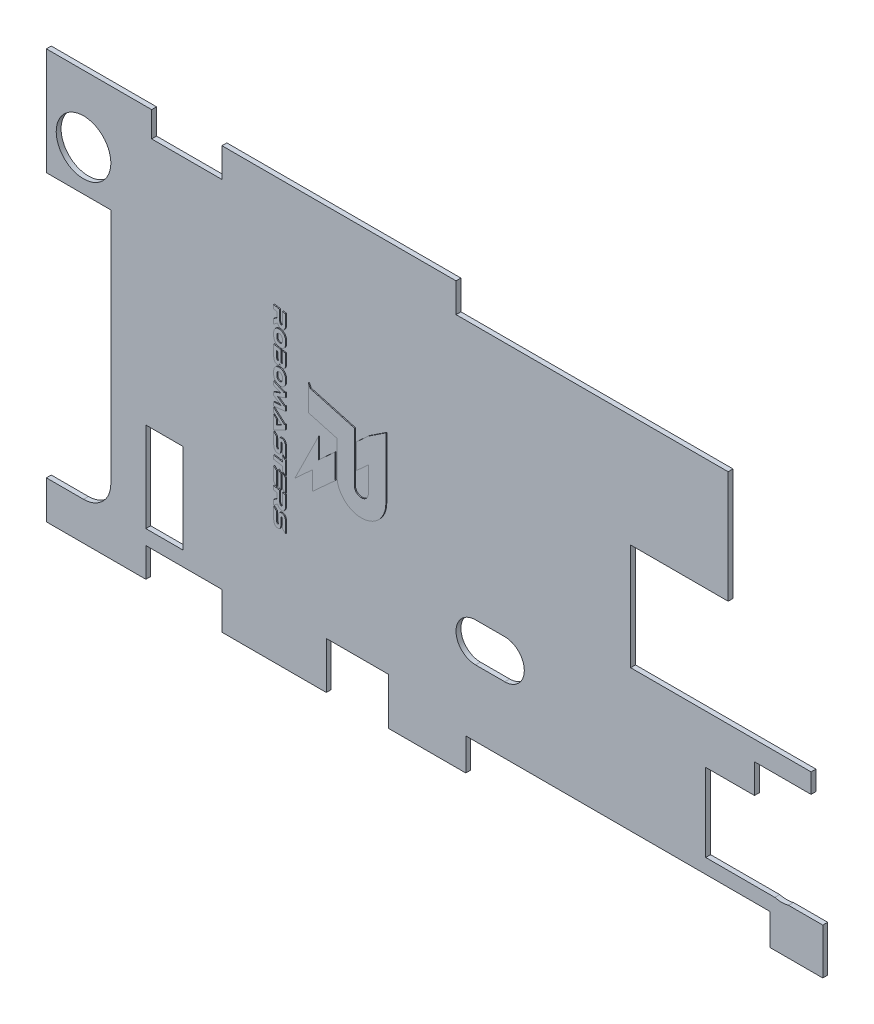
SolidWorks part; units mm, degrees
ref_plane "前视基准面" through (0, 0, 0) normal (0, 0, 1) x (1, 0, 0)
ref_plane "上视基准面" through (0, 0, 0) normal (0, 1, 0) x (1, 0, 0)
ref_plane "右视基准面" through (0, 0, 0) normal (1, 0, 0) x (0, 0, -1)
ref_plane "基准面4" through (0, 0, 0.5) normal (0, 0, 1) x (1, 0, 0)
sketch "草图1" plane through (0, 0, 0.5) normal (0, 0, 1) x (1, 0, 0)
  line L0 (69.9, -42.7) -> (69.9, 0)
  line L1 (69.9, 0) -> (0, 0)
  line L2 (0, 0) -> (0, -42.7)
  line L3 (0, -42.7) -> (69.9, -42.7)
extrude "凸台-拉伸1" add sketch "草图1" against normal blind 0.5
sketch "草图2" plane through (0, 0, 0.5) normal (0, 0, 1) x (1, 0, 0)
  line L0 (10.8, 0) -> (10.8, -2.6)
  line L1 (10.8, -2.6) -> (69.9, -2.6)
  line L2 (69.9, -2.6) -> (69.9, 0)
  line L3 (69.9, 0) -> (10.8, 0)
extrude "切除-拉伸1" cut sketch "草图2" against normal through all
sketch "草图3" plane through (0, -2.6, 0) normal (0, 1, 0) x (-1, 0, 0)
  line L0 (-18, 0.5) -> (-18, 0)
  line L1 (-18, 0) -> (-69.9, 0)
  line L2 (-69.9, 0) -> (-69.9, 0.5)
  line L3 (-69.9, 0.5) -> (-18, 0.5)
extrude "凸台-拉伸2" add sketch "草图3" along normal blind 3
sketch "草图4" plane through (0, 0, 0.5) normal (0, 0, 1) x (1, 0, 0)
  line L0 (69.9, -42.7) -> (69.9, -14.1)
  line L1 (69.9, -14.1) -> (59.9, -14.1)
  line L2 (59.9, -14.1) -> (59.9, -42.7)
  line L3 (59.9, -42.7) -> (69.9, -42.7)
extrude "切除-拉伸2" cut sketch "草图4" against normal through all
sketch "草图5" plane through (59.9, 0, 0) normal (1, 0, 0) x (0, 0, -1)
  line L0 (0, -42.7) -> (-0.5, -42.7)
  line L1 (-0.5, -42.7) -> (-0.5, -25)
  line L2 (-0.5, -25) -> (0, -25)
  line L3 (0, -25) -> (0, -42.7)
extrude "凸台-拉伸3" add sketch "草图5" along normal blind 19.7
sketch "草图6" plane through (0, 0, 0.5) normal (0, 0, 1) x (1, 0, 0)
  line L0 (18, -42.7) -> (18, -39)
  line L1 (18, -39) -> (0, -39)
  line L2 (0, -39) -> (0, -42.7)
  line L3 (0, -42.7) -> (18, -42.7)
extrude "切除-拉伸3" cut sketch "草图6" against normal through all
sketch "草图7" plane through (0, -39, 0) normal (0, -1, 0) x (1, 0, 0)
  line L0 (10.2, 0.5) -> (10.2, 0)
  line L1 (10.2, 0) -> (0, 0)
  line L2 (0, 0) -> (0, 0.5)
  line L3 (0, 0.5) -> (10.2, 0.5)
extrude "凸台-拉伸4" add sketch "草图7" along normal blind 3
sketch "草图8" plane through (0, 0, 0.5) normal (0, 0, 1) x (1, 0, 0)
  line L0 (79.6, -25) -> (67.6, -25)
  line L1 (67.6, -25) -> (67.6, -38)
  line L2 (67.6, -38) -> (79.6, -38)
  line L3 (79.6, -38) -> (79.6, -25)
extrude "切除-拉伸4" cut sketch "草图8" against normal through all
sketch "草图9" plane through (67.6, 0, 0) normal (1, 0, 0) x (0, 0, -1)
  line L0 (-0.5, -25) -> (0, -25)
  line L1 (0, -25) -> (0, -30)
  line L2 (0, -30) -> (-0.5, -30)
  line L3 (-0.5, -30) -> (-0.5, -25)
extrude "凸台-拉伸5" add sketch "草图9" along normal blind 10.8
sketch "草图10" plane through (0, 0, 0.5) normal (0, 0, 1) x (1, 0, 0)
  line L0 (73.2, -42.7) -> (73.2, -39.5)
  line L1 (73.2, -39.5) -> (18, -39.5)
  line L2 (18, -39.5) -> (18, -42.7)
  line L3 (18, -42.7) -> (73.2, -42.7)
extrude "切除-拉伸5" cut sketch "草图10" against normal through all
sketch "草图11" plane through (0, -39.5, 0) normal (0, -1, 0) x (1, 0, 0)
  line L0 (18, 0) -> (18, 0.5)
  line L1 (18, 0.5) -> (43, 0.5)
  line L2 (43, 0.5) -> (43, 0)
  line L3 (43, 0) -> (18, 0)
extrude "凸台-拉伸6" add sketch "草图11" along normal blind 3.3
sketch "草图12" plane through (0, 0, 0) normal (0, 0, -1) x (-1, 0, 0)
  line L0 (-35.1, -42.8) -> (-28.7, -42.8)
  line L1 (-28.7, -42.8) -> (-28.7, -38)
  line L2 (-28.7, -38) -> (-35.1, -38)
  line L3 (-35.1, -38) -> (-35.1, -42.8)
extrude "切除-拉伸6" cut sketch "草图12" against normal through all
sketch "草图13" plane through (0, 0, 0) normal (0, 0, -1) x (-1, 0, 0)
  line L0 (-74.6858, -38) -> (-76.0942, -38)
  arc A0 (-76.0942, -38) -> (-74.6858, -38) centre (-75.39, -35.29) ccw
extrude "切除-拉伸7" cut sketch "草图13" against normal through all
sketch "草图14" plane through (0, 0, 0) normal (0, 0, -1) x (-1, 0, 0)
  line L0 (-72.6, -27) -> (-78.4, -27)
  line L1 (-78.4, -27) -> (-78.4, -30)
  line L2 (-78.4, -30) -> (-72.6, -30)
  line L3 (-72.6, -30) -> (-72.6, -27)
extrude "切除-拉伸8" cut sketch "草图14" against normal through all
sketch "草图15" plane through (0, 0, 0) normal (0, 0, -1) x (-1, 0, 0)
  line L0 (-42, -2.6) -> (-42, 0.4)
  line L1 (-42, 0.4) -> (-69.9, 0.4)
  line L2 (-69.9, 0.4) -> (-69.9, -2.6)
  line L3 (-69.9, -2.6) -> (-42, -2.6)
extrude "切除-拉伸9" cut sketch "草图15" against normal through all
sketch "草图16" plane through (0, 0, 0) normal (0, 0, -1) x (-1, 0, 0)
  line L0 (0, -38.09) -> (0, -11)
  line L1 (0, -11) -> (-6.61, -11)
  line L2 (-6.61, -11) -> (-6.61, -38.09)
  line L3 (-6.61, -38.09) -> (0, -38.09)
extrude "切除-拉伸10" cut sketch "草图16" against normal through all
sketch "草图17" plane through (0, 0, 0.5) normal (0, 0, 1) x (1, 0, 0)
  line L0 (10.2, -37.5) -> (14, -37.5)
  line L1 (14, -37.5) -> (14, -28.3)
  line L2 (14, -28.3) -> (10.2, -28.3)
  line L3 (10.2, -28.3) -> (10.2, -37.5)
extrude "切除-拉伸11" cut sketch "草图17" against normal through all
sketch "草图18" plane through (0, 0, 0) normal (0, 0, -1) x (-1, 0, 0)
  line L0 (-47, -32.7) -> (-44, -32.7)
  line L1 (-44, -28.7) -> (-47, -28.7)
  arc A0 (-44, -32.7) -> (-44, -28.7) centre (-44, -30.7) ccw
  arc A1 (-47, -28.7) -> (-47, -32.7) centre (-47, -30.7) ccw
extrude "切除-拉伸12" cut sketch "草图18" against normal through all
ref_plane "基准面5" through (0, 0, 0.8) normal (0, 0, -1) x (0, 1, 0)
ref_plane "基准面6" through (0, 0, 0.3) normal (0, 0, 1) x (1, 0, 0)
hole_wizard "Ø5.6 (5.6) 直径孔1" positions "草图37" profile "草图36" hole size "Ø5.6" standard "ANSI Metric"
sketch "草图37" plane through (0, 0, 0) normal (0, 0, -1) x (-1, 0, 0)
  point P0 (-3.81, -6.84)
sketch "草图36" plane through (3.81, -6.84, 0) normal (1, 0, 0) x (0, 1, 0)
  line L0 (0, 0) -> (0, 0.5)
  line L1 (0, 0.5) -> (2.8, 0.5)
  line L2 (2.8, 0.5) -> (2.8, 0)
  line L5 (2.8, 0) -> (0, 0)
  line L11 (0, -6.35) -> (0, 107.95) construction
  dimension "通孔孔直径" = 5.6
  dimension "通孔孔深度" = 0.5
fillet "圆角11" radius 2.8 1 edges at (6.61, -38.09, 0.25)
sketch "草图38" plane through (0, 0, 0.5) normal (0, 0, 1) x (1, 0, 0)
  line L1 (59.9, -14.1) -> (59.9, -25) construction
  line L2 (69.9, -2.6) -> (42, -2.6) construction
  dimension "D1" = 25
  dimension "D2" = 14
sketch_block_instance "块2-1"
sketch_block "块2"
sketch_block_instance "BLOCK 2-1"
sketch_block "BLOCK 2"
extrude "凸台-拉伸21" add sketch "草图38" along normal blind 0.1
sketch "草图40" plane through (0, 0, 0.5) normal (0, 0, 1) x (1, 0, 0)
  line L1 (73.2, -42.7) -> (74.2, -42.7)
  line L2 (73.2, -42.7) -> (73.2, -39.5)
  line L3 (73.2, -39.5) -> (74.2, -39.5)
  line L4 (74.2, -42.7) -> (74.2, -39.5)
  dimension "D1" = 1
  dimension "D2" = 3.2
extrude "切除-拉伸16" cut sketch "草图40" against normal through all
